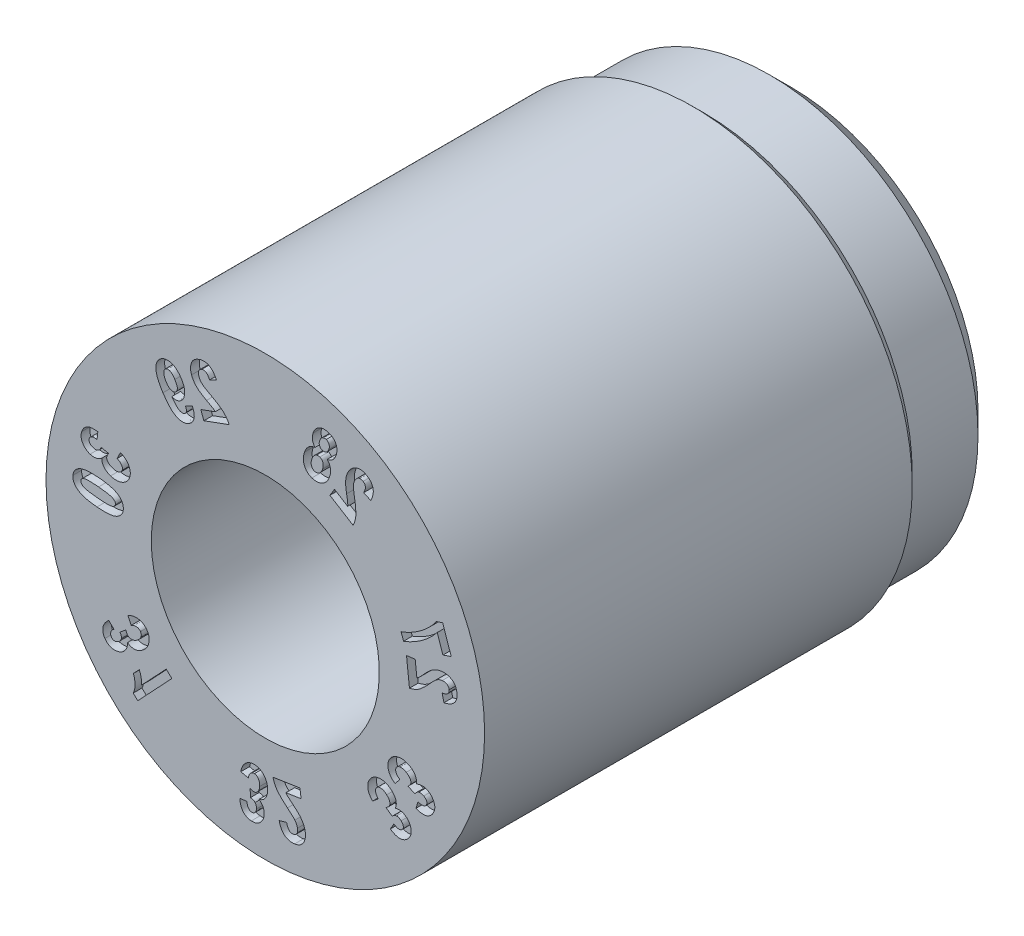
SolidWorks part; units mm, degrees
ref_plane "Front Plane" through (0, 0, 0) normal (0, 0, 1) x (1, 0, 0)
ref_plane "Top Plane" through (0, 0, 0) normal (0, 1, 0) x (1, 0, 0)
ref_plane "Right Plane" through (0, 0, 0) normal (1, 0, 0) x (0, 0, -1)
sketch "Sketch2" plane through (0, 0, 0) normal (0, 1, 0) x (1, 0, 0)
  line L0 (0, 4.8491) -> (0, -49995.1509) construction
  line L10 (4.2496, 12) -> (1.25, 12)
  line L11 (4.75, 11.4996) -> (4.2496, 12)
  line L12 (4.75, 10) -> (4.75, 11.4996)
  line L13 (5, 9.75) -> (4.75, 10)
  line L14 (5, 0) -> (5, 9.75)
  line L15 (2.6, 0) -> (5, 0)
  line L16 (2.6, 0) -> (2.6, 8.871)
  line L17 (1.25, 8.871) -> (2.6, 8.871)
  line L18 (1.25, 8.871) -> (1.25, 12)
  dimension "D1" = 10
  dimension "D2" = 5.2
  dimension "D3" = 3.129
  dimension "D4" = 2.5
  dimension "D5" = 9.5
  dimension "D6" = 12
  dimension "D7" = 45
  dimension "D8" = 45
  dimension "D9" = 2
  dimension "D10" = 0.5004
revolve "Revolve1" add sketch "Sketch2" angle 360 about L0
sketch "Sketch8" plane through (0, 0, 0) normal (0, 0, 1) x (1, 0, 0)
  circle A30 centre (0, 0) radius 3.2897 construction
  text T0 "27    28    29    30    31    32    33" font "Arial Narrow" height 1.12
extrude "Cut-Extrude2" cut sketch "Sketch8" against normal blind 0.2
